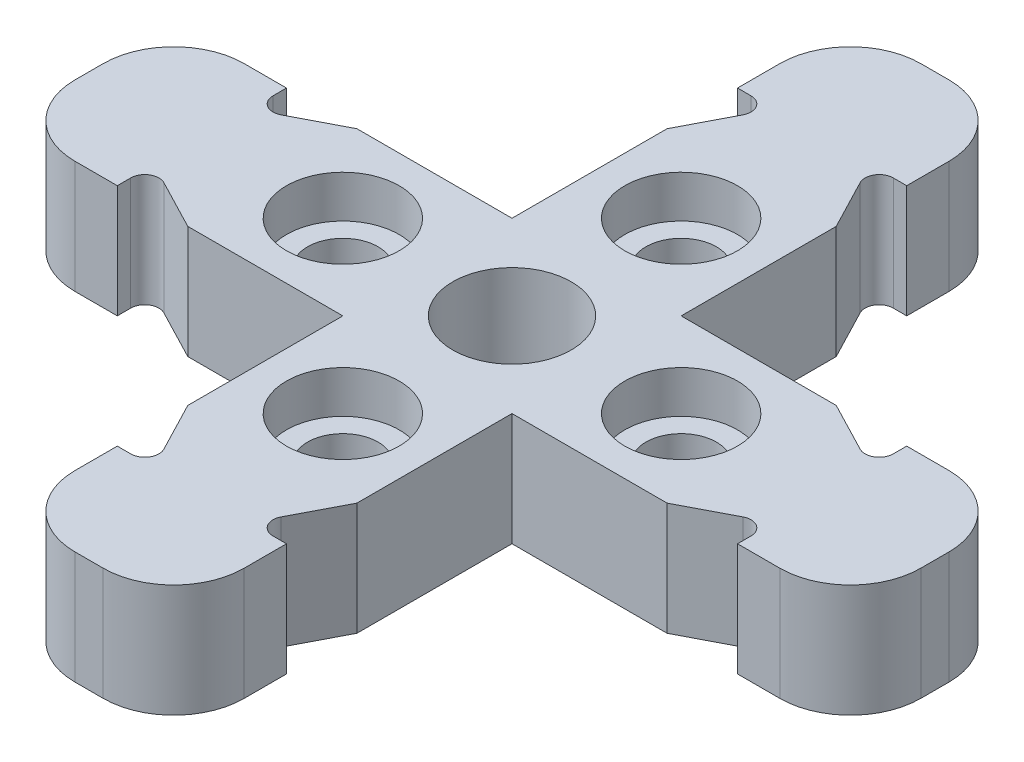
SolidWorks part; units mm, degrees
ref_plane "Ebene vorne" through (0, 0, 0) normal (0, 0, 1) x (1, 0, 0)
ref_plane "Ebene oben" through (0, 0, 0) normal (0, 1, 0) x (1, 0, 0)
ref_plane "Ebene rechts" through (0, 0, 0) normal (1, 0, 0) x (0, 0, -1)
sketch "Skizze1" plane through (0, 0, 0) normal (0, 1, 0) x (1, 0, 0)
  line L0 (-3, 15) -> (-3, 3)
  line L1 (-3, 3) -> (-15, 3)
  line L2 (-15, 3) -> (-15, -3)
  line L3 (-15, -3) -> (-3, -3)
  line L4 (-3, -3) -> (-3, -15)
  line L5 (-3, -15) -> (3, -15)
  line L6 (3, -15) -> (3, -3)
  line L7 (3, -3) -> (15, -3)
  line L8 (15, -3) -> (15, 3)
  line L9 (15, 3) -> (3, 3)
  line L10 (3, 3) -> (3, 15)
  line L11 (3, 15) -> (-3, 15)
  line L12 (0, 29.9552) -> (0, -18.8507) construction
  line L13 (0, -55) -> (0, 55) construction
  line L14 (-41.3731, 0) -> (49.2537, 0) construction
  line L15 (-55, 0) -> (55, 0) construction
  line L16 (-11, 3) -> (-11, 2.5236)
  line L17 (-10.2693, 2.08) -> (-8.5, 3)
  line L18 (-11, -3) -> (-11, -2.5236)
  line L19 (-10.2693, -2.08) -> (-8.5, -3)
  line L20 (10.2693, -2.08) -> (8.5, -3)
  line L21 (11, -3) -> (11, -2.5236)
  line L22 (11, 3) -> (11, 2.5236)
  line L23 (10.2693, 2.08) -> (8.5, 3)
  line L24 (3, -11) -> (2.5236, -11)
  line L25 (2.08, -10.2693) -> (3, -8.5)
  line L26 (-2.08, -10.2693) -> (-3, -8.5)
  line L27 (-3, -11) -> (-2.5236, -11)
  line L28 (-3, 11) -> (-2.5236, 11)
  line L29 (-2.08, 10.2693) -> (-3, 8.5)
  line L30 (3, 11) -> (2.5236, 11)
  line L31 (2.08, 10.2693) -> (3, 8.5)
  arc A0 (-11, 2.5236) -> (-10.2693, 2.08) centre (-10.5, 2.5236) ccw
  arc A1 (-11, -2.5236) -> (-10.2693, -2.08) centre (-10.5, -2.5236) cw
  arc A2 (11, -2.5236) -> (10.2693, -2.08) centre (10.5, -2.5236) ccw
  arc A3 (11, 2.5236) -> (10.2693, 2.08) centre (10.5, 2.5236) cw
  arc A4 (2.5236, -11) -> (2.08, -10.2693) centre (2.5236, -10.5) cw
  arc A5 (-2.5236, -11) -> (-2.08, -10.2693) centre (-2.5236, -10.5) ccw
  arc A6 (-2.5236, 11) -> (-2.08, 10.2693) centre (-2.5236, 10.5) cw
  arc A7 (2.5236, 11) -> (2.08, 10.2693) centre (2.5236, 10.5) ccw
  point P26 (-11, 1.7)
  point P64 (0, 0)
  dimension "D8" = 0.5
  dimension "D1" = 6
  dimension "D2" = 6
  dimension "D3" = 6
  dimension "D4" = 30
  dimension "D5" = 30
  dimension "D6" = 1.3
  dimension "D7" = 2.5
  dimension "D10" = 4
  dimension "D9" = 2
extrude "Aufsatz-Linear austragen1" add sketch "Skizze1" along normal blind 4 contours A7 L30 L10 L11 L0 L28 A6 L29 L1 L17 A0 L16 L2 L3 L18 A1 L19 L4 L26 A5 L27 L5 L6 L24 A4 L25 L7 L20 A2 L21 L8 L9 L22 A3 L23 L31
fillet "Verrundung1" radius 2.5 8 edges at (15, 2, -3) (15, 2, 3) (3, 2, 15) (-3, 2, 15) (-15, 2, 3) (-15, 2, -3) (-3, 2, -15) (3, 2, -15)
sketch "Skizze3" plane through (0, 4, 0) normal (0, 1, 0) x (1, 0, 0)
  line L0 (0, 0) -> (0, 6)
  line L1 (0, -2.2) -> (0, 2.2) construction
  circle A1 centre (0, 6) radius 1.25
  circle A2 centre (6, 0) radius 1.25
  circle A3 centre (0, -6) radius 1.25
  circle A4 centre (-6, 0) radius 1.25
  point P16 (0, 0)
  dimension "D1" = 2.5
  dimension "D2" = 6
  dimension "D3" = 4
extrude "Schnitt-Linear austragen1" cut sketch "Skizze3" against normal blind 4
sketch "Skizze4" plane through (0, 4, 0) normal (0, 1, 0) x (1, 0, 0)
  circle A0 centre (0, 6) radius 2
  circle A1 centre (6, 0) radius 2
  circle A2 centre (0, -6) radius 2
  circle A3 centre (-6, 0) radius 2
  point P12 (0, 0)
  dimension "D1" = 4
  dimension "D2" = 4
extrude "Schnitt-Linear austragen2" cut sketch "Skizze4" against normal blind 1.5
sketch "Skizze5" plane through (0, 4, 0) normal (0, 1, 0) x (1, 0, 0)
  circle A0 centre (0, 0) radius 2.1
  dimension "D1" = 4.2
extrude "Schnitt-Linear austragen3" cut sketch "Skizze5" against normal through all
